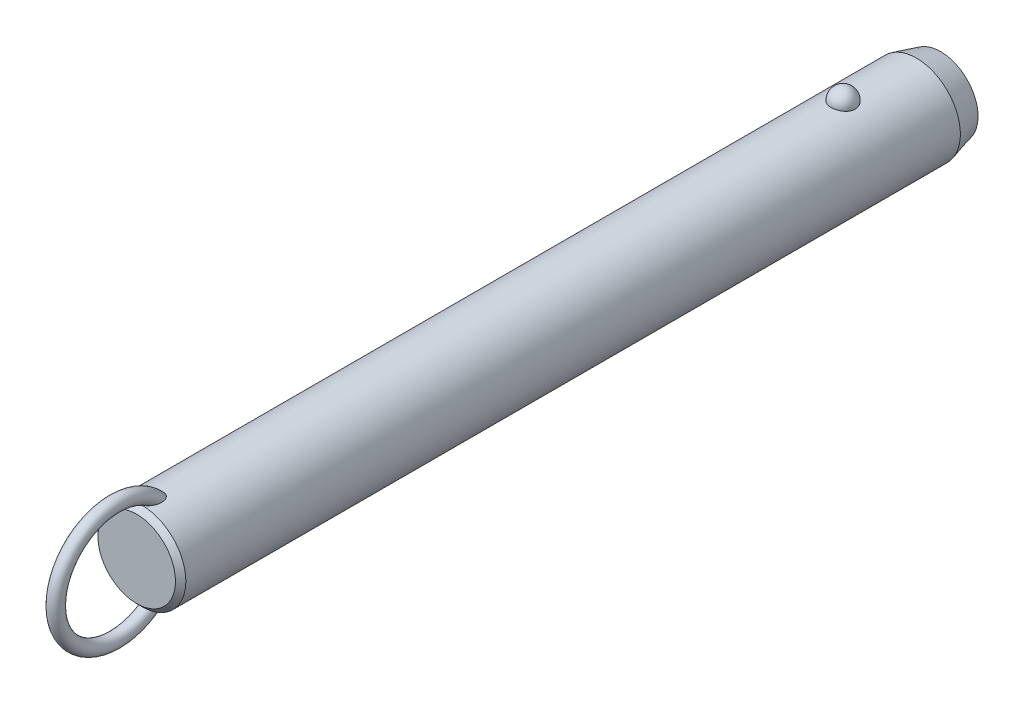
SolidWorks part; units mm, degrees
ref_plane "Front Plane" through (0, 0, 0) normal (0, 0, 1) x (1, 0, 0)
ref_plane "Top Plane" through (0, 0, 0) normal (0, 1, 0) x (1, 0, 0)
ref_plane "Right Plane" through (0, 0, 0) normal (1, 0, 0) x (0, 0, -1)
sketch "Sketch2" plane through (0, 0, 0) normal (0, 0, 1) x (1, 0, 0)
  circle A0 centre (0, 0) radius 12.7
  point P3 (0, 12.7)
  dimension "D1" = 25.4
extrude "Boss-Extrude1" add sketch "Sketch2" along normal blind 188
sketch "Sketch3" plane through (0, 0, 0) normal (0, 0, -1) x (-1, 0, 0)
  circle A0 centre (0, 0) radius 12.7
  dimension "D1" = 25.4
extrude "Boss-Extrude2" add sketch "Sketch3" along normal blind 31.7
chamfer "Chamfer1" distance 7 angle 15 1 edges at (-12.7, 0, -31.7)
sketch "Sketch12" plane through (0, 0, 0) normal (1, 0, 0) x (0, 0, -1)
  line L0 (-188, 12.7) -> (-188, -12.7) construction
  point P0 (-188, 0)
sketch "Sketch13" plane through (0, 0, 0) normal (1, 0, 0) x (0, 0, -1)
  circle A0 centre (-207.05, 0) radius 19.05
  point P2 (-188, 0)
  dimension "D1" = 38.1
sketch "Sketch14" plane through (0, 0, 0) normal (0, 1, 0) x (1, 0, 0)
  circle A0 centre (0, -190) radius 2
  point P2 (0, -188)
  dimension "D1" = 4
sweep "Sweep1" add profiles "Sketch14" path "Sketch13"
sketch "Sketch15" plane through (0, 0, 188) normal (0, 0, 1) x (1, 0, 0)
  circle A0 centre (0, 0) radius 12.7
  dimension "D1" = 25.4
extrude "Boss-Extrude3" add sketch "Sketch15" along normal blind 12.7
chamfer "Chamfer2" distance 1.5 angle 45 1 edges at (12.7, 0, 200.7)
sketch "Sketch18" plane through (0, 0, 0) normal (1, 0, 0) x (0, 0, -1)
  line L0 (24.7, 12.7) -> (-192.851, 12.7) construction
  line L1 (3.5, 16.2) -> (3.5, 9.2)
  line L2 (-192.851, -12.7) -> (24.7, -12.7) construction
  arc A0 (3.5, 16.2) -> (3.5, 9.2) centre (3.5, 12.7) ccw
  point P4 (0, 12.7)
  dimension "D1" = 28.9
revolve "Revolve1" add sketch "Sketch18" angle 360 about L1
